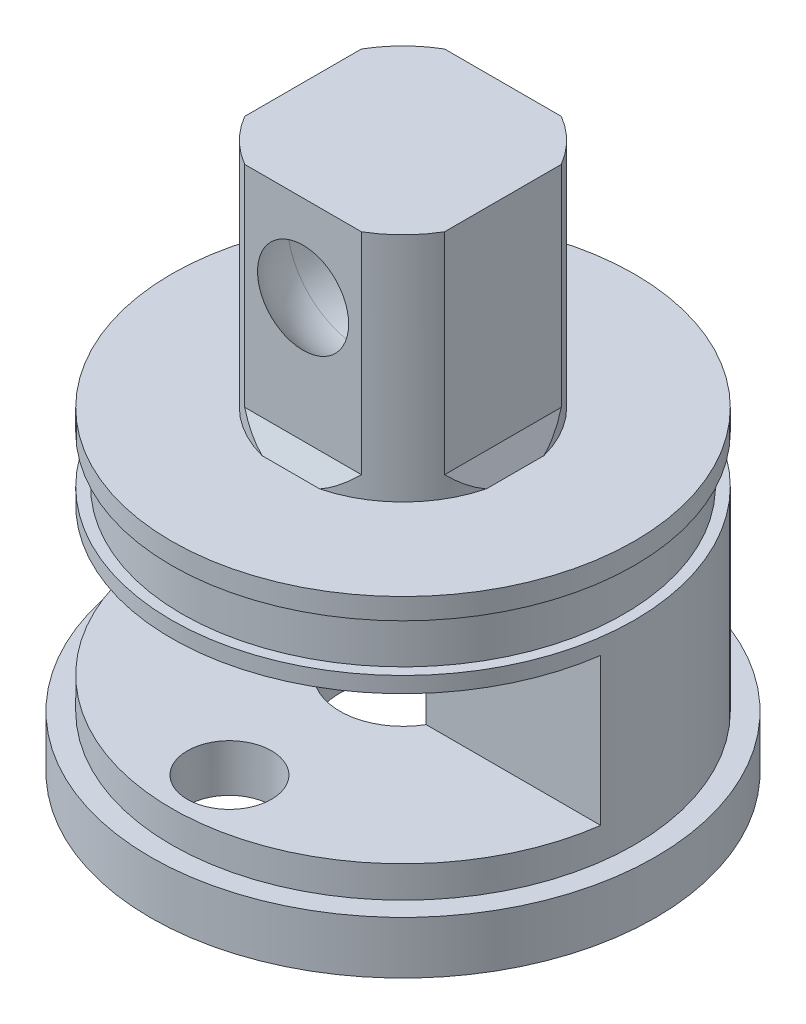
SolidWorks part; units mm, degrees
ref_plane "Face" through (0, 0, 0) normal (0, 0, 1) x (1, 0, 0)
ref_plane "Dessus" through (0, 0, 0) normal (0, 1, 0) x (1, 0, 0)
ref_plane "Droite" through (0, 0, 0) normal (1, 0, 0) x (0, 0, -1)
sketch "Esquisse1" plane through (0, 0, 0) normal (0, 0, 1) x (1, 0, 0)
  line L0 (0, 0) -> (0, 62.1939) construction
  line L1 (3, 0) -> (10.5, 0)
  line L2 (10.5, 0) -> (10.5, -1.75)
  line L3 (10.5, -1.75) -> (12, -1.75)
  line L4 (12, -1.75) -> (12, 0.75)
  line L5 (12, 0.75) -> (11, 0.75)
  line L6 (11, 0.75) -> (11, 10)
  line L7 (10.5, 10) -> (10.5, 12.25)
  line L8 (11, 12.25) -> (11, 13.25)
  line L9 (11, 13.25) -> (5.5, 13.25)
  line L10 (5.5, 13.25) -> (5.5, 24.25)
  line L11 (5.5, 24.25) -> (0, 24.25)
  line L12 (0, 24.25) -> (0, 13)
  line L13 (11, 10) -> (10.5, 10)
  line L14 (10.5, 12.25) -> (11, 12.25)
  line L15 (0, 13) -> (3, 13)
  line L16 (3, 13) -> (3, 0)
  dimension "D1" = 10.5
  dimension "D2" = 1.5
  dimension "D3" = 1.75
  dimension "D4" = 2.5
  dimension "D5" = 1
  dimension "D6" = 9.25
  dimension "D7" = 0.5
  dimension "D8" = 2.25
  dimension "D9" = 1
  dimension "D10" = 5.5
  dimension "D11" = 11
  dimension "D12" = 3
  dimension "D13" = 13
revolve "Base-Révolution" add sketch "Esquisse1" angle 360 about L0
ref_plane "Plan1" through (0, 0, 1.5) normal (0, 0, 1) x (1, 0, 0)
sketch "Esquisse2" plane through (0, 0, 1.5) normal (0, 0, 1) x (1, 0, 0)
  line L0 (-12, -1.75) -> (12, -1.75) construction
  line L1 (-14.2361, 9.25) -> (16.3296, 9.25)
  line L2 (-14.2361, 9.25) -> (-14.2361, 2.25)
  line L3 (-14.2361, 2.25) -> (16.3296, 2.25)
  line L4 (16.3296, 9.25) -> (16.3296, 2.25)
  dimension "D1" = 4
  dimension "D2" = 7
extrude "Enlèv. mat.-Extru.3" cut sketch "Esquisse2" along normal blind 10
sketch "Esquisse3" plane through (0, 0, 0) normal (0, -1, 0) x (1, 0, 0)
  line L0 (0, 0) -> (0, 14.956) construction
  line L1 (12.6, 1.5) -> (-12.6, 1.5) construction
  circle A0 centre (0, 8.25) radius 2
  dimension "D1" = 4
  dimension "D2" = 6.75
extrude "Enlèv. mat.-Extru.5" cut sketch "Esquisse3" against normal blind 11
sketch "Esquisse4" plane through (0, 24.25, 0) normal (0, 1, 0) x (-1, 0, 0)
  line L0 (0, 0) -> (-10.8117, 0) construction
  line L1 (-4.75, -4.75) -> (4.75, -4.75)
  line L2 (-4.75, -4.75) -> (-4.75, 4.75)
  line L3 (-4.75, 4.75) -> (4.75, 4.75)
  line L4 (4.75, -4.75) -> (4.75, 4.75)
  line L5 (0, 0) -> (0, 7.4775) construction
  line L6 (-6.75, -6.75) -> (6.75, -6.75)
  line L7 (6.75, -6.75) -> (6.75, 6.75)
  line L8 (-6.75, 6.75) -> (6.75, 6.75)
  line L9 (-6.75, -6.75) -> (-6.75, 6.75)
  dimension "D1" = 9.5
  dimension "D2" = 9.5
  dimension "D3" = 2
extrude "Enlèv. mat.-Extru.6" cut sketch "Esquisse4" against normal blind 10
sketch "Esquisse5" plane through (0, 14.25, 0) normal (0, 1, 0) x (-1, 0, 0)
  line L8 (-6.75, -6.75) -> (6.75, -6.75)
  line L9 (6.75, -6.75) -> (6.75, 6.75)
  line L10 (-6.75, 6.75) -> (6.75, 6.75)
  line L11 (-6.75, -6.75) -> (-6.75, 6.75)
  line L20 (-4.75, 4.75) -> (4.75, 4.75)
  line L21 (4.75, -4.75) -> (4.75, 4.75)
  line L22 (-4.75, -4.75) -> (4.75, -4.75)
  line L23 (-4.75, -4.75) -> (-4.75, 4.75)
extrude "Enlèv. mat.-Extru.7" cut sketch "Esquisse5" against normal blind 1 draft 30
sketch "Esquisse6" plane through (0, 0, 4.75) normal (0, 0, 1) x (1, 0, 0)
  line L0 (0, 26.2561) -> (0, 15.8979) construction
  line L1 (0, 11) -> (0, 9.25) construction
  circle A0 centre (0, 20.1474) radius 2
  dimension "D1" = 4
extrude "Enlèv. mat.-Extru.8" cut sketch "Esquisse6" against normal blind 8.5
ref_plane "Plan2" through (0, 0, 2) normal (0, 0, 1) x (1, 0, 0)
sketch "Esquisse8" plane through (0, 0, 2) normal (0, 0, 1) x (1, 0, 0)
  line L0 (0, 23.6002) -> (0, 16.0041) construction
  line L1 (0, 11) -> (0, 9.25) construction
  line L2 (0, 23.6474) -> (0, 16.6474)
  arc A0 (0, 16.6474) -> (0, 23.6474) centre (0, 20.1474) ccw
  circle A1 centre (0, 20.1474) radius 2 construction
  dimension "D1" = 7
revolve "Enlèvement de matière-Révolution2" cut sketch "Esquisse8" angle 360 about L0
sketch "Esquisse9" plane through (0, 0, 2) normal (0, 0, 1) x (1, 0, 0)
  circle A0 centre (0, 20.1474) radius 3.5 construction
  circle A1 centre (0, 20.1474) radius 3.5
extrude "Enlèv. mat.-Extru.9" cut sketch "Esquisse9" against normal blind 3
